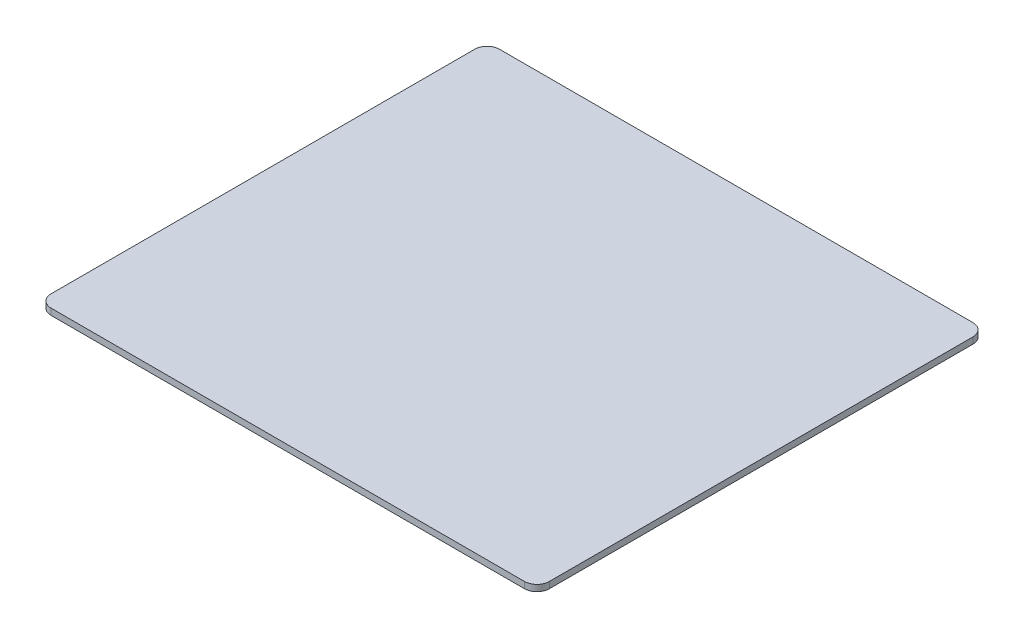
SolidWorks part; units mm, degrees
ref_plane "Front Plane" through (0, 0, 0) normal (0, 0, 1) x (1, 0, 0)
ref_plane "Top Plane" through (0, 0, 0) normal (0, 1, 0) x (1, 0, 0)
ref_plane "Right Plane" through (0, 0, 0) normal (1, 0, 0) x (0, 0, -1)
sketch "Sketch1" plane through (0, 0, 0) normal (0, 1, 0) x (1, 0, 0)
  line L1 (-12.226, -12.863) -> (7.774, -12.863)
  line L2 (-12.226, -12.863) -> (-12.226, 5.137)
  line L3 (-12.226, 5.137) -> (7.774, 5.137)
  line L4 (7.774, -12.863) -> (7.774, 5.137)
  dimension "D1" = 18
  dimension "D2" = 20
extrude "Boss-Extrude1" add sketch "Sketch1" along normal blind 0.254
fillet "Fillet1" radius 0.5 4 edges at (7.774, 0.127, -5.137) (7.774, 0.127, 12.863) (-12.226, 0.127, -5.137) (-12.226, 0.127, 12.863)
